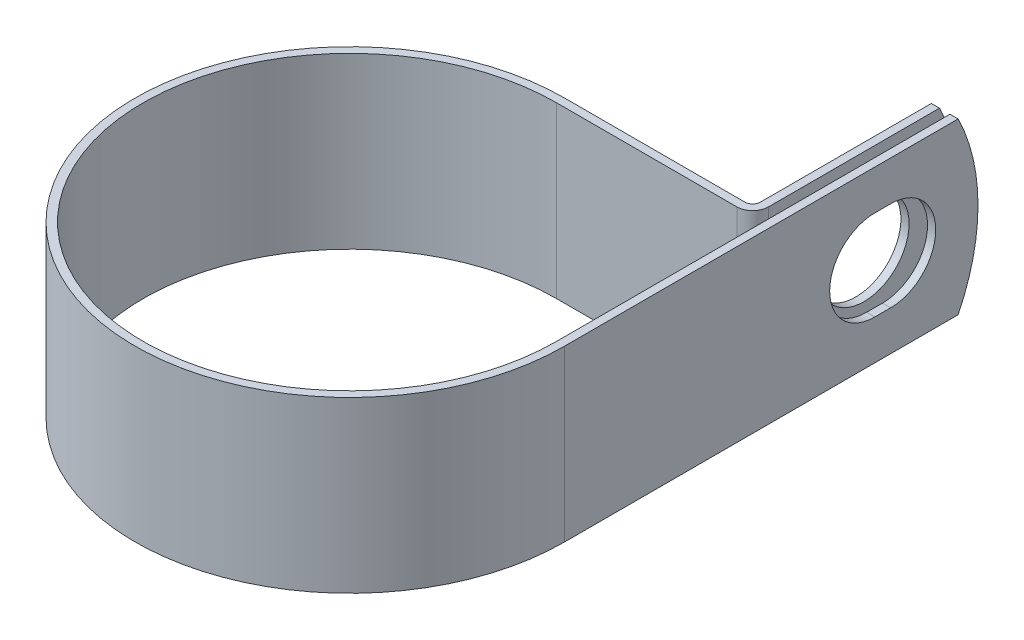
SolidWorks part; units mm, degrees
ref_plane "Front Plane" through (0, 0, 0) normal (0, 0, 1) x (1, 0, 0)
ref_plane "Top Plane" through (0, 0, 0) normal (0, 1, 0) x (1, 0, 0)
ref_plane "Right Plane" through (0, 0, 0) normal (1, 0, 0) x (0, 0, -1)
sketch "Sketch1" plane through (0, 0, 0) normal (0, 1, 0) x (1, 0, 0)
  line L0 (0, 30.9499) -> (26.9977, 30.9499)
  line L1 (30.9499, 0) -> (30.9499, 30.9499)
  line L2 (29.3751, 61.8998) -> (29.3751, 33.3273)
  line L5 (30.9499, 30.9499) -> (30.9499, 61.8998)
  arc A0 (0, 30.9499) -> (30.9499, 0) centre (0, 0) ccw
  arc A3 (26.9977, 30.9499) -> (29.3751, 33.3273) centre (26.9977, 33.3273) ccw
extrude "Extrude-Thin1" add sketch "Sketch1" along normal mid plane 25.4 thin
sketch "Sketch2" plane through (28.1559, 0, 0) normal (-1, 0, 0) x (0, 0, 1)
  line L0 (-61.8998, 12.7) -> (-61.8998, -12.7) construction
  line L7 (0, 12.7) -> (0, -12.7) construction
  circle A0 centre (-47.625, 0) radius 6.7437
  point P2 (-61.8998, 0)
extrude "Cut-Extrude1" cut sketch "Sketch2" against normal up to surface (1.2192 mm away)
sketch "Sketch3" plane through (32.1691, 0, 0) normal (1, 0, 0) x (0, 0, -1)
  line L0 (46.4312, 0) -> (48.8188, 0) construction
  line L1 (46.4312, 6.7437) -> (48.8188, 6.7437)
  line L2 (46.4312, -6.7437) -> (48.8188, -6.7437)
  line L3 (61.8998, 12.7) -> (61.8998, -12.7) construction
  arc A0 (46.4312, 6.7437) -> (46.4312, -6.7437) centre (46.4312, 0) ccw
  arc A1 (48.8188, -6.7437) -> (48.8188, 6.7437) centre (48.8188, 0) ccw
  point P3 (47.625, 0)
  point P8 (61.8998, 0)
  point P11 (39.6875, 0)
  point P12 (55.5625, 0)
extrude "Cut-Extrude2" cut sketch "Sketch3" against normal up to surface (1.2192 mm away)
sketch "Sketch4" plane through (28.1559, 0, 0) normal (-1, 0, 0) x (0, 0, 1)
  line L0 (-61.8998, 12.7) -> (-61.8998, -12.7)
  line L1 (-61.8998, 12.7) -> (-58.9225, 12.7)
  line L2 (-61.8998, 12.7) -> (-33.3273, 12.7) construction
  line L3 (-61.8998, -12.7) -> (-58.9225, -12.7)
  line L4 (-61.8998, -12.7) -> (-33.3273, -12.7) construction
  arc A0 (-58.9225, 12.7) -> (-58.9225, -12.7) centre (-33.3248, 0) ccw
extrude "Cut-Extrude3" cut sketch "Sketch4" against normal through all contours A0 M4 M5 | A0 L0 M2
equation "\"D1@Sketch3\" = \"D2@Sketch2\""
equation "\"D7@Sketch1\" = \"D3@Sketch2\" + \"D1@Sketch3\""
equation "\"D1@Sketch4\" = ( \"D1@Extrude-Thin1\" + .125 ) * 2"
equation "\"D2@Sketch1\"=1.95*\"D5@Extrude-Thin1\""
equation "\"D2@Sketch3\" = \"D1@Sketch2\""
